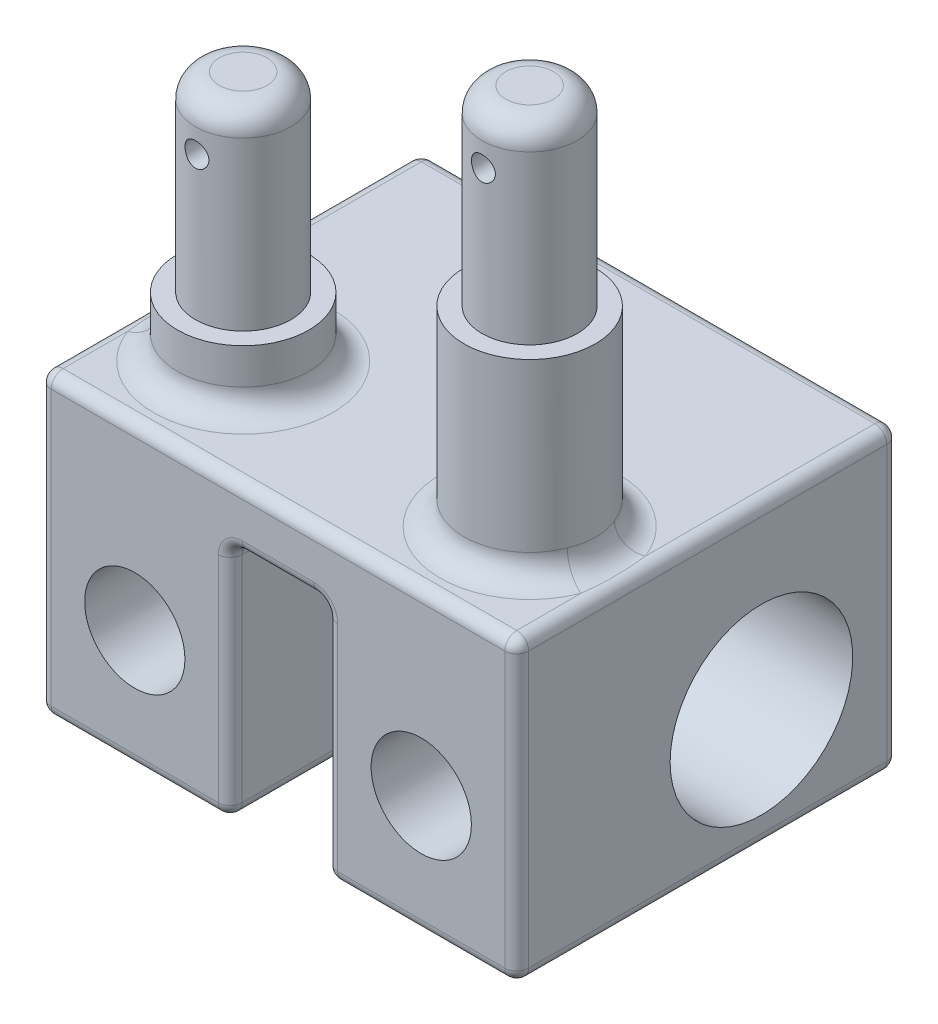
SolidWorks part; units mm, degrees
ref_plane "Front Plane" through (0, 0, 0) normal (0, 0, 1) x (1, 0, 0)
ref_plane "Top Plane" through (0, 0, 0) normal (0, 1, 0) x (1, 0, 0)
ref_plane "Right Plane" through (0, 0, 0) normal (1, 0, 0) x (0, 0, -1)
sketch "Sketch1" plane through (0, 0, 0) normal (0, 1, 0) x (1, 0, 0)
  line L1 (-64.3662, 27.4922) -> (-24.3662, 27.4922)
  line L2 (-64.3662, 27.4922) -> (-64.3662, -2.5078)
  line L3 (-64.3662, -2.5078) -> (-24.3662, -2.5078)
  line L4 (-24.3662, 27.4922) -> (-24.3662, -2.5078)
  line L5 (-64.3662, 27.4922) -> (-24.3662, -2.5078) construction
  line L6 (-64.3662, -2.5078) -> (-24.3662, 27.4922) construction
  point P0 (-44.3662, 12.4922)
  dimension "D1" = 40
  dimension "D2" = 30
extrude "Boss-Extrude1" add sketch "Sketch1" along normal blind 5 contours L1 L4 L3 L2
sketch "Sketch2" plane through (-64.3662, 0, 0) normal (-1, 0, 0) x (0, 0, 1)
  line L0 (-27.4922, 0) -> (-8.4922, -20) construction
  line L1 (-27.4922, 0) -> (-8.4922, 0)
  line L2 (-27.4922, 0) -> (-27.4922, -20)
  line L3 (-27.4922, -20) -> (-8.4922, -20)
  line L4 (-8.4922, 0) -> (-8.4922, -20)
  line L5 (-8.4922, 0) -> (-27.4922, -20) construction
  circle A0 centre (-17.9922, -10) radius 7.65
  dimension "D3" = 15.3
  dimension "D1" = 19
  dimension "D2" = 20
extrude "Boss-Extrude2" add sketch "Sketch2" against normal blind 40
sketch "Sketch3" plane through (0, 0, -8.4922) normal (0, 0, 1) x (1, 0, 0)
  line L0 (-56.3662, -10) -> (-32.3662, -10) construction
  line L1 (-24.3662, -20) -> (-64.3662, -20) construction
  line L2 (-64.3662, -20) -> (-64.3662, 0) construction
  line L3 (-64.3662, 0) -> (-24.3662, 0) construction
  line L4 (-64.3662, 0) -> (-48.3662, 0)
  line L5 (-64.3662, 0) -> (-64.3662, -20)
  line L6 (-64.3662, -20) -> (-48.3662, -20)
  line L7 (-48.3662, 0) -> (-48.3662, -20)
  line L8 (-24.3662, 0) -> (-64.3662, 0) construction
  line L9 (-40.3662, 0) -> (-24.3662, 0)
  line L10 (-40.3662, 0) -> (-40.3662, -20)
  line L11 (-40.3662, -20) -> (-24.3662, -20)
  line L12 (-24.3662, 0) -> (-24.3662, -20)
  circle A0 centre (-56.3662, -10) radius 4.2
  circle A1 centre (-32.3662, -10) radius 4.2
  point P4 (-44.3662, -10)
  point P7 (-44.3662, -20)
  point P10 (-64.3662, -10)
  point P23 (-56.3662, 0)
  point P24 (-32.3662, 0)
extrude "Boss-Extrude3" add sketch "Sketch3" along normal blind 11
sketch "Sketch4" plane through (0, 5, 0) normal (0, 1, 0) x (1, 0, 0)
  line L0 (-56.3662, 6.5732) -> (-32.3662, 6.5732) construction
  line L1 (-64.3662, 27.4922) -> (-24.3662, 27.4922) construction
  circle A0 centre (-56.3662, 6.5732) radius 5.5
  circle A1 centre (-32.3662, 6.5732) radius 5.5
  point P6 (-44.3662, 6.5732)
  point P9 (-44.3662, 27.4922)
extrude "Boss-Extrude4" add sketch "Sketch4" along normal blind 5
sketch "Sketch7" plane through (0, 10, 0) normal (0, 1, 0) x (1, 0, 0)
  circle A1 centre (-32.3662, 6.5732) radius 5.5
  circle A2 centre (-32.3662, 6.5732) radius 5.5
  dimension "D1" = 0
extrude "Boss-Extrude7" add sketch "Sketch7" along normal blind 11
sketch "Sketch8" plane through (0, 10, 0) normal (0, 1, 0) x (1, 0, 0)
  circle A0 centre (-56.3662, 6.5732) radius 4
  circle A1 centre (-56.3662, 6.5732) radius 5.5 construction
extrude "Boss-Extrude8" add sketch "Sketch8" along normal blind 16
sketch "Sketch9" plane through (0, 0, 2.5078) normal (0, 0, 1) x (1, 0, 0)
  line L0 (-60.3662, 26) -> (-52.3662, 26) construction
  line L2 (-50.8662, 10) -> (-61.8662, 10) construction
  circle A0 centre (-56.3662, 22) radius 1
  point P7 (-56.3662, 26)
  dimension "D2" = 2
  dimension "D1" = 12
extrude "Cut-Extrude1" cut sketch "Sketch9" against normal through all both and the other way through all
sketch "Sketch10" plane through (0, 21, 0) normal (0, 1, 0) x (1, 0, 0)
  circle A0 centre (-32.3662, 6.5732) radius 4
  circle A1 centre (-32.3662, 6.5732) radius 5.5 construction
extrude "Boss-Extrude9" add sketch "Sketch10" along normal blind 16
sketch "Sketch11" plane through (0, 0, 2.5078) normal (0, 0, 1) x (1, 0, 0)
  line L0 (-37.8662, 21) -> (-26.8662, 21) construction
  circle A0 centre (-32.3662, 33) radius 1
  point P6 (-32.3662, 21)
  dimension "D1" = 2
  dimension "D2" = 12
extrude "Cut-Extrude2" cut sketch "Sketch11" against normal through all both and the other way through all
sketch "Sketch12" plane through (0, 0, -27.4922) normal (0, 0, -1) x (-1, 0, 0)
  line L4 (24.3662, 5) -> (24.3662, -20)
  line L5 (24.3662, -20) -> (64.3662, -20)
  line L6 (64.3662, -20) -> (64.3662, 5)
  line L7 (64.3662, 5) -> (24.3662, 5)
  line L8 (24.3662, 5) -> (24.3662, -20)
  line L9 (24.3662, -20) -> (64.3662, -20)
  line L10 (64.3662, -20) -> (64.3662, 5)
  line L11 (64.3662, 5) -> (24.3662, 5)
  dimension "D1" = 0
extrude "Boss-Extrude10" add sketch "Sketch12" along normal blind 2
fillet "Fillet3" radius 1 24 edges at (-48.3662, -10, -8.4922) (-48.3662, -10, 2.5078) (-40.3662, -10, -8.4922) (-40.3662, -10, 2.5078) (-24.3662, 5, -13.4922) (-44.3662, 5, 2.5078) (-64.3662, 5, -13.4922) (-64.3662, -7.5, -29.4922) (-24.3662, -7.5, -29.4922) (-44.3662, 5, -29.4922) (-48.3662, 0, -2.9922) (-44.3662, 0, 2.5078) (-40.3662, 0, -2.9922) (-44.3662, 0, -8.4922) (-56.3662, -20, 2.5078) (-48.3662, -20, -2.9922) (-44.3662, -20, -8.4922) (-40.3662, -20, -2.9922) (-32.3662, -20, 2.5078) (-64.3662, -20, -13.4922) (-24.3662, -20, -13.4922) (-44.3662, -20, -29.4922) (-64.3662, -7.5, 2.5078) (-24.3662, -7.5, 2.5078)
fillet "Fillet4" radius 2 1 edges at (-56.3662, 5, -1.0732)
fillet "Fillet5" radius 2 1 edges at (-32.3662, 5, -1.0732)
fillet "Fillet7" radius 2 1 edges at (-56.3662, 26, -2.5732)
fillet "Fillet8" radius 2 1 edges at (-32.3662, 37, -2.5732)
equation "\"screws\"= 2.7mm"
equation "\"barra\"= 8mm"
equation "\"a\"= 12.5"
equation "\"b\"= 18"
equation "\"c\"= 29"
equation "\"d\"= 16.5"
equation "\"D2@Sketch3\"=\"barra\"+0.4"
equation "\"D3@Sketch3\"=\"barra\"+0.4"
equation "\"D1@Sketch4\"=\"barra\"+3"
equation "\"D2@Sketch4\"=\"barra\"+3"
equation "\"D1@Sketch8\"=\"barra\""
equation "\"D1@Sketch10\"=\"barra\""
